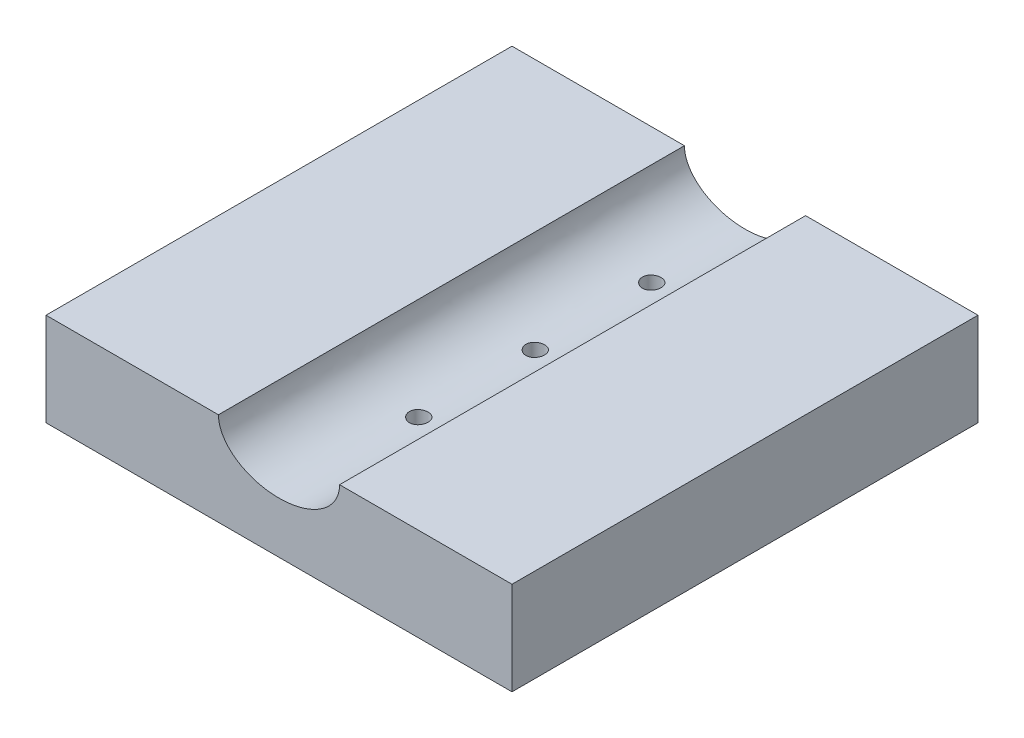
SolidWorks part; units mm, degrees
ref_plane "Front" through (0, 0, 0) normal (0, 0, 1) x (1, 0, 0)
ref_plane "Top" through (0, 0, 0) normal (0, 1, 0) x (1, 0, 0)
ref_plane "Right" through (0, 0, 0) normal (1, 0, 0) x (0, 0, -1)
sketch "草图1" plane through (0, 0, 0) normal (0, 0, 1) x (1, 0, 0)
  line L1 (50, -20) -> (-50, -20)
  line L2 (50, -20) -> (50, 0)
  line L3 (50, 0) -> (13, 0)
  line L4 (-50, -20) -> (-50, 0)
  line L5 (50, -20) -> (-50, 0) construction
  line L6 (50, 0) -> (-50, -20) construction
  line L7 (-13, 0) -> (-50, 0)
  ellipse E0 centre (0, 0) end of major axis (13, 0) minor radius 9 (-13, 0) -> (13, 0) ccw
  point P0 (0, 0)
  dimension "宽度" = 100
  dimension "厚度" = 20
  dimension "长直径" = 26
  dimension "短直径" = 18
extrude "凸台-拉伸1" add sketch "草图1" along normal blind 100
sketch "草图2" plane through (0, 0, 0) normal (0, 1, 0) x (1, 0, 0)
  line L0 (50, 0) -> (13, 0) construction
  circle A0 centre (0, -20) radius 2
  dimension "孔径" = 4
  dimension "端距" = 20
extrude "切除-拉伸1" cut sketch "草图2" against normal through all
pattern_linear "阵列(线性)1" count 3 spacing 25 along (0, 0, 1) of "切除-拉伸1"
